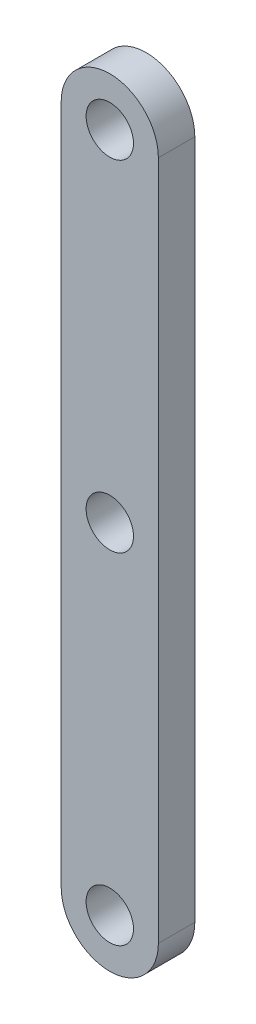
SolidWorks part; units mm, degrees
ref_plane "前视基准面" through (0, 0, 0) normal (0, 0, 1) x (1, 0, 0)
ref_plane "上视基准面" through (0, 0, 0) normal (0, 1, 0) x (1, 0, 0)
ref_plane "右视基准面" through (0, 0, 0) normal (1, 0, 0) x (0, 0, -1)
sketch "草图1" plane through (0, 0, 0) normal (0, 0, 1) x (1, 0, 0)
  line L0 (0, 0) -> (0, 56) construction
  line L1 (-4, 0) -> (-4, 56)
  line L2 (4, 0) -> (4, 56)
  arc A0 (-4, 0) -> (4, 0) centre (0, 0) ccw
  arc A1 (4, 56) -> (-4, 56) centre (0, 56) ccw
  point P3 (0, 28)
  dimension "D1" = 4
  dimension "D2" = 56
extrude "凸台-拉伸1" add sketch "草图1" along normal blind 3
hole_wizard "Ø3.9 (3.9) 直径孔1" positions "草图2" profile "草图3" hole size "Ø3.9" standard "GB"
sketch "草图2" plane through (0, 0, 3) normal (0, 0, 1) x (1, 0, 0)
  point P0 (0, 56)
  point P3 (0, 0)
sketch "草图3" plane through (0, 56, 3) normal (1, 0, 0) x (0, -1, 0)
  line L0 (0, 0) -> (0, 3)
  line L1 (0, 3) -> (1.95, 3)
  line L2 (1.95, 3) -> (1.95, 0)
  line L5 (1.95, 0) -> (0, 0)
  line L11 (0, -6.35) -> (0, 107.95) construction
  dimension "通孔孔直径" = 3.9
  dimension "通孔孔深度" = 3
hole_wizard "Ø3.9 (3.9) 直径孔2" positions "草图4" profile "草图5" hole size "Ø3.9" standard "GB"
sketch "草图4" plane through (0, 0, 3) normal (0, 0, 1) x (1, 0, 0)
  line L0 (0, 56) -> (0, 0) construction
  point P6 (0, 28)
sketch "草图5" plane through (0, 28, 3) normal (1, 0, 0) x (0, -1, 0)
  line L0 (0, 0) -> (0, 3)
  line L1 (0, 3) -> (1.95, 3)
  line L2 (1.95, 3) -> (1.95, 0)
  line L5 (1.95, 0) -> (0, 0)
  line L11 (0, -6.35) -> (0, 107.95) construction
  dimension "通孔孔直径" = 3.9
  dimension "通孔孔深度" = 3
